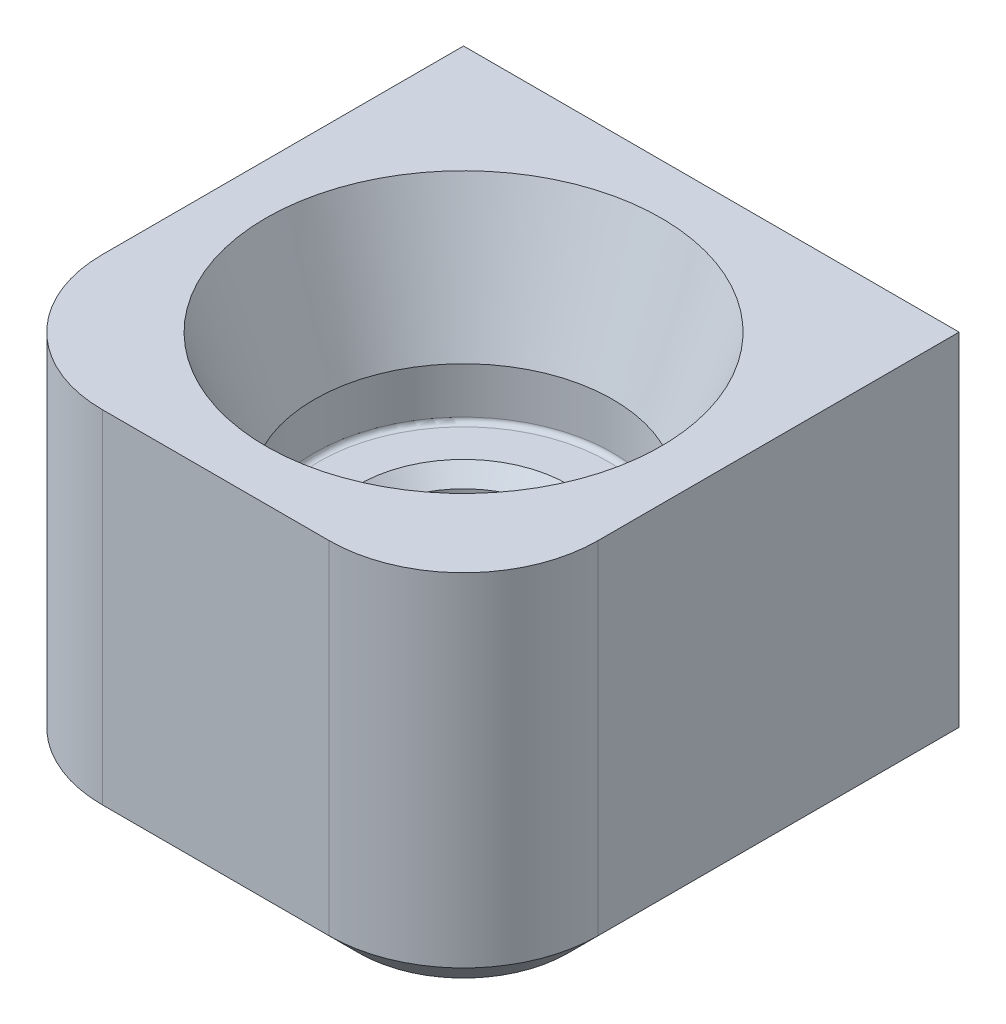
SolidWorks part; units mm, degrees
ref_plane "Front Plane" through (0, 0, 0) normal (0, 0, 1) x (1, 0, 0)
ref_plane "Top Plane" through (0, 0, 0) normal (0, 1, 0) x (1, 0, 0)
ref_plane "Right Plane" through (0, 0, 0) normal (1, 0, 0) x (0, 0, -1)
sketch "Sketch1" plane through (0, 0, 0) normal (0, 1, 0) x (1, 0, 0)
  line L0 (-6.3246, 6.3246) -> (6.3246, -6.3246) construction
  line L1 (-6.3246, 6.3246) -> (6.3246, 6.3246)
  line L2 (-6.3246, 6.3246) -> (-6.3246, -2.8956)
  line L3 (-2.8956, -6.3246) -> (2.8956, -6.3246)
  line L4 (6.3246, 6.3246) -> (6.3246, -2.8956)
  arc A0 (2.8956, -6.3246) -> (6.3246, -2.8956) centre (2.8956, -2.8956) ccw
  arc A1 (-6.3246, -2.8956) -> (-2.8956, -6.3246) centre (-2.8956, -2.8956) ccw
  point P4 (0, 0)
  point P7 (0, 0)
  point P13 (-6.3246, -6.3246)
  dimension "D3" = 3.429
  dimension "D1" = 12.6492
  dimension "D2" = 12.6492
extrude "Boss-Extrude1" add sketch "Sketch1" along normal blind 9.4996
sketch "Sketch2" plane through (0, 0, 0) normal (0, 0, 1) x (1, 0, 0)
  line L0 (0, 9.4996) -> (0, 0) construction
  line L1 (-2.8956, 9.4996) -> (2.8956, 9.4996) construction
  line L2 (-2.8956, 0) -> (2.8956, 0) construction
  line L4 (-5.045, 9.4996) -> (-3.81, 6.1064)
  line L5 (-3.683, 4.8006) -> (-2.286, 4.8006)
  line L6 (-2.286, 4.8006) -> (-2.286, 0)
  line L7 (-2.286, 0) -> (0, 0)
  line L8 (0, 9.4996) -> (0, 0)
  line L9 (-3.81, 6.1064) -> (-3.81, 4.9276)
  line L10 (2.286, 4.8006) -> (2.286, 0) construction
  line L11 (3.81, 4.8006) -> (2.286, 4.8006) construction
  line L12 (3.81, 6.1064) -> (3.81, 4.8006) construction
  line L13 (5.045, 9.4996) -> (3.81, 6.1064) construction
  line L14 (0, 9.4996) -> (-5.045, 9.4996)
  circle A0 centre (0, 9.5631) radius 4.7625 construction
  arc A1 (-3.683, 4.8006) -> (-3.81, 4.9276) centre (-3.683, 4.9276) cw
  point P20 (-3.81, 4.8006)
  dimension "D3" = 9.525
  dimension "D7" = 4.826
  dimension "D9" = 0.127
  dimension "D1" = 4.572
  dimension "D2" = 3.81
  dimension "D4" = 4.699
  dimension "D5" = 40
  dimension "D6" = 3.3932
  dimension "D8" = 7.62
revolve "Cut-Revolve1" cut sketch "Sketch2" angle 360 about L0
chamfer "Chamfer1" distance 0.762 angle 45 6 edges at (-6.3246, 0, -1.7145) (-5.3203, 0, 5.3203) (0, 0, 6.3246) (5.3203, 0, 5.3203) (0, 0, -6.3246) (6.3246, 0, -1.7145)
chamfer "Chamfer2" distance 0.381 angle 45 2 edges at (-2.286, 4.8006, 0) (-2.286, 0, 0)
